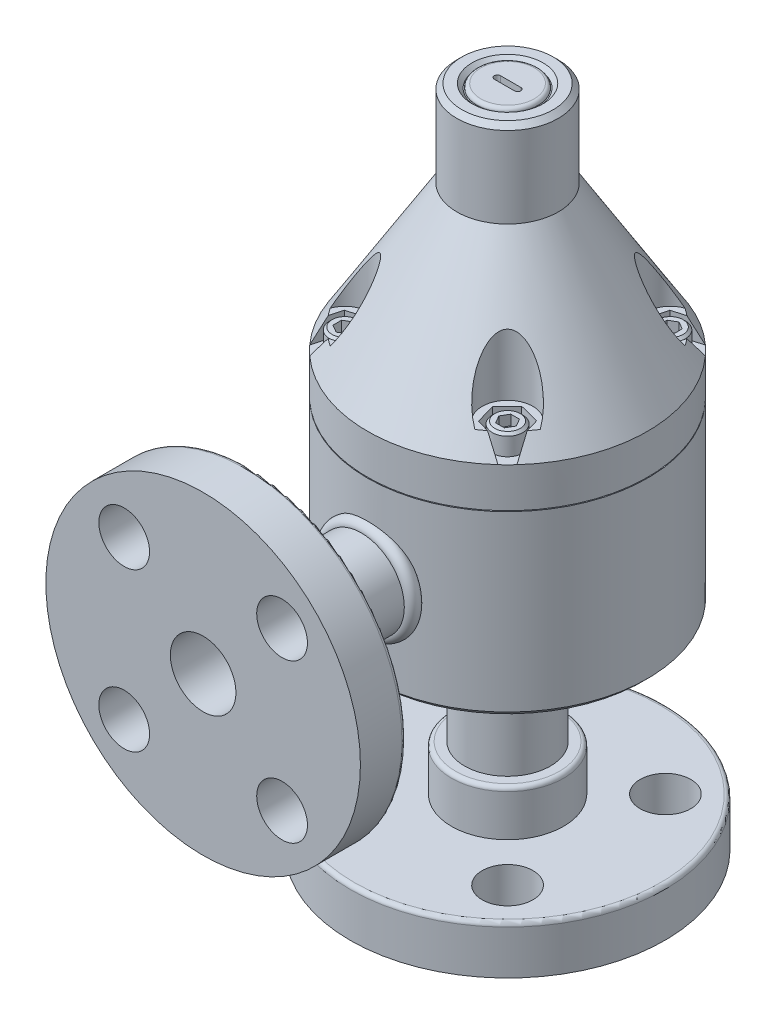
SolidWorks part; units mm, degrees
ref_plane "Front Plane" through (0, 0, 0) normal (0, 0, 1) x (1, 0, 0)
ref_plane "Top Plane" through (0, 0, 0) normal (0, 1, 0) x (1, 0, 0)
ref_plane "Right Plane" through (0, 0, 0) normal (1, 0, 0) x (0, 0, -1)
sketch "Sketch1" plane through (0, 0, 0) normal (0, 1, 0) x (1, 0, 0)
  circle A0 centre (0, 0) radius 43.815
  dimension "D1" = 87.63
extrude "Extrude1" add sketch "Sketch1" along normal blind 140.97
sketch "Sketch2" plane through (0, 0, 0) normal (0, 0, 1) x (1, 0, 0)
  line L0 (0, 0) -> (0, 140.97) construction
  line L1 (43.815, 140.97) -> (-43.815, 140.97) construction
  line L2 (-43.815, 56.134) -> (-43.815, 68.58)
  line L3 (-43.815, 56.134) -> (-30.226, 56.134)
  line L4 (-30.226, 56.134) -> (-30.226, 55.88)
  line L6 (-30.226, 55.88) -> (-49.4473, 55.88)
  line L7 (-49.4473, 55.88) -> (-49.4473, 147.034)
  line L8 (-49.4473, 147.034) -> (-15.875, 147.034)
  line L9 (-15.875, 147.034) -> (-15.875, 114.046)
  line L10 (-15.875, 114.046) -> (-43.815, 68.58)
  line L12 (-43.815, 0) -> (43.815, 0) construction
  dimension "D1" = 43.815
  dimension "D2" = 55.88
  dimension "D3" = 0.254
  dimension "D4" = 30.226
  dimension "D5" = 15.875
  dimension "D6" = 68.58
  dimension "D7" = 26.924
revolve "Cut-Revolve1" cut sketch "Sketch2" angle 360 about L0
ref_plane "Plane1" through (0, 140.97, 0) normal (0, 1, 0) x (-1, 0, 0)
sketch "Sketch3" plane through (0, 140.97, 0) normal (0, 1, 0) x (-1, 0, 0)
  circle A0 centre (0, 0) radius 11.1125
  dimension "D1" = 22.225
extrude "Extrude2" cut sketch "Sketch3" against normal blind 1.27 draft 45
chamfer "Chamfer1" distance 1.5748 angle 45 2 edges at (0, 0, 43.815) (0, 140.97, 15.875)
sketch "Sketch4" plane through (0, 140.97, 0) normal (0, 1, 0) x (-1, 0, 0)
  circle A0 centre (0, 0) radius 9.525
  dimension "D1" = 19.05
extrude "Extrude3" add sketch "Sketch4" against normal up to surface (1.27 mm away)
fillet "Fillet1" radius 1.143 1 edges at (0, 140.97, 9.525)
sketch "Sketch5" plane through (0, 140.97, 0) normal (0, 1, 0) x (-1, 0, 0)
  line L0 (-3.175, 0) -> (3.175, 0) construction
  line L1 (3.175, 0.9652) -> (-3.175, 0.9652)
  line L2 (-3.175, -0.9652) -> (3.175, -0.9652)
  arc A0 (-3.175, 0.9652) -> (-3.175, -0.9652) centre (-3.175, 0) ccw
  arc A1 (3.175, -0.9652) -> (3.175, 0.9652) centre (3.175, 0) ccw
  dimension "D1" = 3.175
  dimension "D2" = 6.35
  dimension "D3" = 0.9652
  dimension "D4" = 0.9652
extrude "Extrude4" cut sketch "Sketch5" against normal blind 3.302 draft 1
ref_plane "Plane2" through (0, 74.93, 0) normal (0, 1, 0) x (-1, 0, 0)
sketch "Sketch6" plane through (0, 74.93, 0) normal (0, 1, 0) x (-1, 0, 0)
  line L0 (0, 0) -> (-43.815, 0) construction
  line L1 (0, 0) -> (-30.9819, 30.9819) construction
  circle A0 centre (0, 0) radius 43.815 construction
  circle A1 centre (0, 0) radius 36.0045 construction
  circle A2 centre (-25.459, 25.459) radius 7.9375
  dimension "D1" = 72.009
  dimension "D2" = 15.875
extrude "Extrude5" cut sketch "Sketch6" along normal blind 22.86
sketch "Sketch8" plane through (0, 74.93, 0) normal (0, 1, 0) x (-1, 0, 0)
  line L0 (0, 0) -> (-30.9819, 30.9819) construction
  line L1 (-30.9819, 19.758) -> (-19.9362, 31.1601) construction
  line L2 (-30.9819, 30.9819) -> (-39.3973, 39.3973) construction
  line L3 (-29.9486, 20.8246) -> (-23.6903, 19.2537)
  line L4 (-23.6903, 19.2537) -> (-19.2007, 23.8882)
  line L5 (-19.2007, 23.8882) -> (-20.9694, 30.0935)
  line L9 (-29.9486, 20.8246) -> (-33.5917, 33.5917)
  line L10 (-33.5917, 33.5917) -> (-20.9694, 30.0935)
  line L12 (-27.2278, 31.6643) -> (-31.7174, 27.0299)
  line L13 (-20.9694, 30.0935) -> (-27.2278, 31.6643)
  line L14 (-31.7174, 27.0299) -> (-29.9486, 20.8246)
  circle A0 centre (0, 0) radius 43.815 construction
  arc A1 (-32.876, 22.6318) -> (-22.6318, 32.876) centre (-25.459, 25.459) ccw construction
  arc A2 (-32.876, 22.6318) -> (-22.6318, 32.876) centre (-25.459, 25.459) ccw construction
  circle A3 centre (-25.459, 25.459) radius 5.588 construction
extrude "Extrude6" cut sketch "Sketch8" against normal blind 6.35
pattern_circular "CirPattern1" count 4 over 360 about axis through (0, 0, 0) along (0, 1, 0) of "Extrude5", "Extrude6"
sketch "Sketch9" plane through (0, 74.93, 0) normal (0, 1, 0) x (-1, 0, 0)
  line L0 (0, 0) -> (-25.459, 25.459) construction
  circle A0 centre (-25.459, 25.459) radius 4.7625
  dimension "D1" = 9.525
extrude "Extrude7" add sketch "Sketch9" against normal up to surface (6.35 mm away)
sketch "Sketch10" plane through (0, 74.93, 0) normal (0, 1, 0) x (-1, 0, 0)
  line L1 (-28.1871, 25.459) -> (-26.8231, 23.0964)
  line L2 (-26.8231, 23.0964) -> (-24.095, 23.0964)
  line L3 (-24.095, 23.0964) -> (-22.7309, 25.459)
  line L4 (-22.7309, 25.459) -> (-24.095, 27.8216)
  line L5 (-24.095, 27.8216) -> (-26.8231, 27.8216)
  line L6 (-26.8231, 27.8216) -> (-28.1871, 25.459)
  circle A0 centre (-25.459, 25.459) radius 2.3626 construction
extrude "Extrude8" cut sketch "Sketch10" against normal blind 3.175
pattern_circular "CirPattern2" count 4 over 360 about axis through (0, 0, 0) along (0, 1, 0) of "Extrude7", "Extrude8"
chamfer "Chamfer2" distance 0.762 angle 45 4 edges at (-25.459, 74.93, -30.2215) (30.2215, 74.93, -25.459) (25.459, 74.93, 30.2215) (-30.2215, 74.93, 25.459)
ref_plane "Plane3" through (0, 0, 95.25) normal (0, 0, 1) x (1, 0, 0)
sketch "Sketch11" plane through (0, 0, 95.25) normal (0, 0, 1) x (1, 0, 0)
  line L0 (0, 0) -> (0, 140.97) construction
  line L1 (14.3002, 140.97) -> (-14.3002, 140.97) construction
  line L2 (-43.815, 28.575) -> (43.815, 28.575) construction
  line L3 (-43.815, 55.88) -> (-43.815, 1.5748) construction
  line L4 (43.815, 1.5748) -> (43.815, 55.88) construction
  line L5 (-42.2402, 0) -> (42.2402, 0) construction
  circle A0 centre (0, 28.575) radius 49.2125
  dimension "D2" = 98.425
  dimension "D1" = 28.575
extrude "Boss-Extrude1" add sketch "Sketch11" against normal blind 14.2748 separate body
sketch "Sketch12" plane through (0, 0, 95.25) normal (0, 0, 1) x (1, 0, 0)
  circle A0 centre (0, 28.575) radius 17.4625
  dimension "D1" = 34.925
extrude "Boss-Extrude2" add sketch "Sketch12" against normal blind 26.2128
sketch "Sketch13" plane through (0, 0, 95.25) normal (0, 0, 1) x (1, 0, 0)
  circle A0 centre (0, 28.575) radius 13.4366
  dimension "D1" = 26.8732
extrude "Boss-Extrude3" add sketch "Sketch13" against normal up to surface (53.5461 mm away)
sketch "Sketch14" plane through (0, 0, 95.25) normal (0, 0, 1) x (1, 0, 0)
  circle A0 centre (0, 28.575) radius 10.2616
  dimension "D1" = 20.5232
extrude "Cut-Extrude1" cut sketch "Sketch14" against normal blind 25.4
sketch "Sketch15" plane through (0, 0, 95.25) normal (0, 0, 1) x (1, 0, 0)
  line L0 (0, 28.575) -> (-49.2125, 28.575) construction
  line L1 (0, 28.575) -> (-34.7985, 63.3735) construction
  circle A0 centre (0, 28.575) radius 49.2125 construction
  circle A1 centre (0, 28.575) radius 34.925 construction
  circle A2 centre (-24.6957, 53.2707) radius 7.9375
  dimension "D2" = 69.85
  dimension "D3" = 15.875
  dimension "D1" = 45
extrude "Cut-Extrude2" cut sketch "Sketch15" against normal blind 25.4
pattern_circular "CirPattern3" count 4 over 360 about axis through (0, 28.575, 0) along (0, 0, 1) of "Cut-Extrude2"
sketch "Sketch16" plane through (0, 0, 0) normal (1, 0, 0) x (0, 0, -1)
  line L0 (-41.2557, 38.1023) -> (-45.7371, 38.1023)
  line L1 (-45.7371, 38.1023) -> (-45.7371, 42.0116)
  line L2 (-43.815, 42.0116) -> (-69.0372, 42.0116) construction
  line L3 (-41.2557, 38.1023) -> (-41.2557, 42.4601)
  line L4 (-95.25, 28.575) -> (0, 28.575) construction
  line L5 (-95.25, 77.7875) -> (-95.25, -20.6375) construction
  arc A0 (-45.7371, 42.0116) -> (-41.2557, 42.4601) centre (-43.4739, 42.0116) cw
revolve "Revolve1" add sketch "Sketch16" angle 360 about L4
ref_plane "Plane5" through (0, -66.675, 0) normal (0, 1, 0) x (1, 0, 0)
sketch "Sketch23" plane through (0, -66.675, 0) normal (0, 1, 0) x (1, 0, 0)
  circle A0 centre (0, 0) radius 49.2125
  dimension "D1" = 98.425
extrude "Boss-Extrude8" add sketch "Sketch23" along normal blind 15.0622 separate body
sketch "Sketch24" plane through (0, -66.675, 0) normal (0, 1, 0) x (1, 0, 0)
  circle A0 centre (0, 0) radius 17.526
  dimension "D1" = 35.052
extrude "Boss-Extrude9" add sketch "Sketch24" along normal blind 29.3624
sketch "Sketch25" plane through (0, -66.675, 0) normal (0, 1, 0) x (1, 0, 0)
  circle A0 centre (0, 0) radius 13.4366
  dimension "D1" = 26.8732
extrude "Boss-Extrude10" add sketch "Sketch25" along normal up to surface (66.675 mm away)
sketch "Sketch26" plane through (0, -66.675, 0) normal (0, 1, 0) x (1, 0, 0)
  circle A0 centre (0, 0) radius 10.2616
  dimension "D1" = 20.5232
extrude "Cut-Extrude5" cut sketch "Sketch26" along normal blind 25.4
fillet "Fillet4" radius 1.27 2 edges at (0, -51.6128, 49.2125) (0, -37.3126, 17.526)
sketch "Sketch27" plane through (0, -66.675, 0) normal (0, 1, 0) x (1, 0, 0)
  line L0 (0, 0) -> (-49.2125, 0) construction
  line L1 (0, 0) -> (-34.7985, -34.7985) construction
  circle A0 centre (0, 0) radius 49.2125 construction
  circle A1 centre (0, 0) radius 34.925 construction
  circle A2 centre (-24.6957, -24.6957) radius 7.9375
  dimension "D2" = 69.85
  dimension "D3" = 15.875
  dimension "D1" = 45
extrude "Cut-Extrude6" cut sketch "Sketch27" along normal blind 25.4
pattern_circular "CirPattern5" count 4 over 360 about axis through (0, 0, 0) along (0, 1, 0) of "Cut-Extrude6"
fillet "Fillet5" radius 1.27 2 edges at (49.2125, 28.575, 80.9752) (17.4625, 28.575, 69.0372)
sketch "Sketch28" plane through (0, 0, 0) normal (1, 0, 0) x (0, 0, -1)
  line L0 (-16.6116, 0.4579) -> (-16.6116, 2.0308)
  line L1 (-16.6116, 2.0308) -> (-12.912, 2.0308)
  line L2 (-12.912, 2.0308) -> (-12.912, -3.175)
  line L3 (0, 0) -> (0, -18.3946) construction
  line L4 (-42.2402, 0) -> (42.2402, 0) construction
  line L5 (-13.4366, 0) -> (-13.4366, -37.3126) construction
  arc A0 (-12.912, -3.175) -> (-16.6116, 0.4579) centre (-13.5083, -0.0821) cw
  dimension "D1" = 3.175
  dimension "D2" = 3.175
revolve "Revolve2" add sketch "Sketch28" angle 360 about L3
